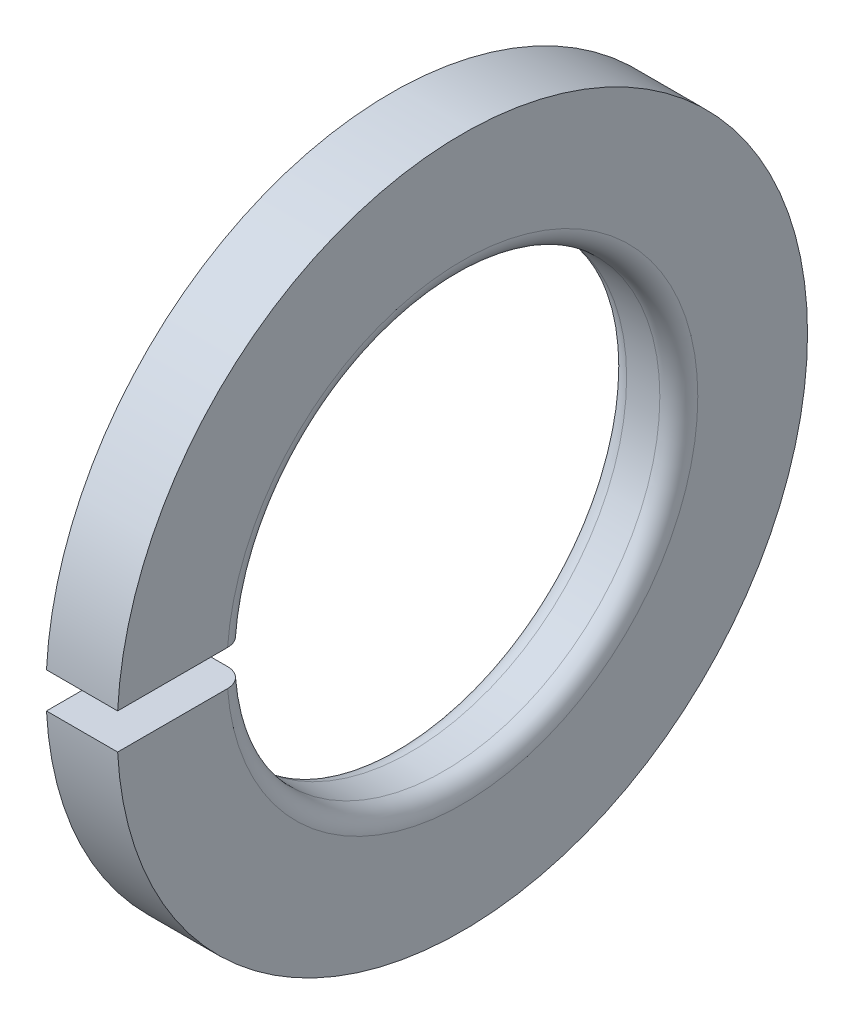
SolidWorks part; units mm, degrees
ref_plane "Plane1" through (0, 0, 0) normal (0, 0, 1) x (1, 0, 0)
ref_plane "Plane2" through (0, 0, 0) normal (0, 1, 0) x (1, 0, 0)
ref_plane "Plane3" through (0, 0, 0) normal (1, 0, 0) x (0, 0, -1)
sketch "Sketch1" plane through (0, 0, 0) normal (0, 0, 1) x (1, 0, 0)
  line L0 (-34.925, 0) -> (9.525, 0) construction
  line L1 (0, 19.85) -> (0, 29.1)
  line L2 (0, 29.1) -> (-6, 29.1)
  line L3 (-6, 29.1) -> (-6, 19.85)
  line L4 (-4.4, 18.25) -> (-1.6, 18.25)
  arc A0 (-4.4, 18.25) -> (-6, 19.85) centre (-4.4, 19.85) cw
  arc A1 (0, 19.85) -> (-1.6, 18.25) centre (-1.6, 19.85) cw
  point P8 (-6, 18.25)
  dimension "Fillet_rad" = 1.6
  dimension "D1" = 1.6
  dimension "Thickness" = 6
  dimension "Inside_dia" = 36.5
  dimension "Outside_dia" = 58.2
revolve "Base-Revolve" add sketch "Sketch1" angle 360 about L0
sketch "Sketch2" plane through (0, 0, 0) normal (-1, 0, 0) x (0, -1, 0)
  line L0 (-1.5, 0) -> (1.5, 0)
  line L1 (0, 0) -> (0, 12.7) construction
  line L2 (1.5, 0) -> (1.5, 29.682)
  line L3 (1.5, 29.682) -> (-1.5, 29.682)
  line L4 (-1.5, 29.682) -> (-1.5, 0)
  dimension "D1" = 3
  dimension "D2" = 29.682
extrude "Gap" cut sketch "Sketch2" along normal through all
equation "\"D1@Sketch1\" = \"Fillet_rad@Sketch1\""
equation "\"D1@Sketch2\" = \"Thickness@Sketch1\" * 0.5"
equation "\"D2@Sketch2\" = \"Outside_dia@Sketch1\" * 0.51"
